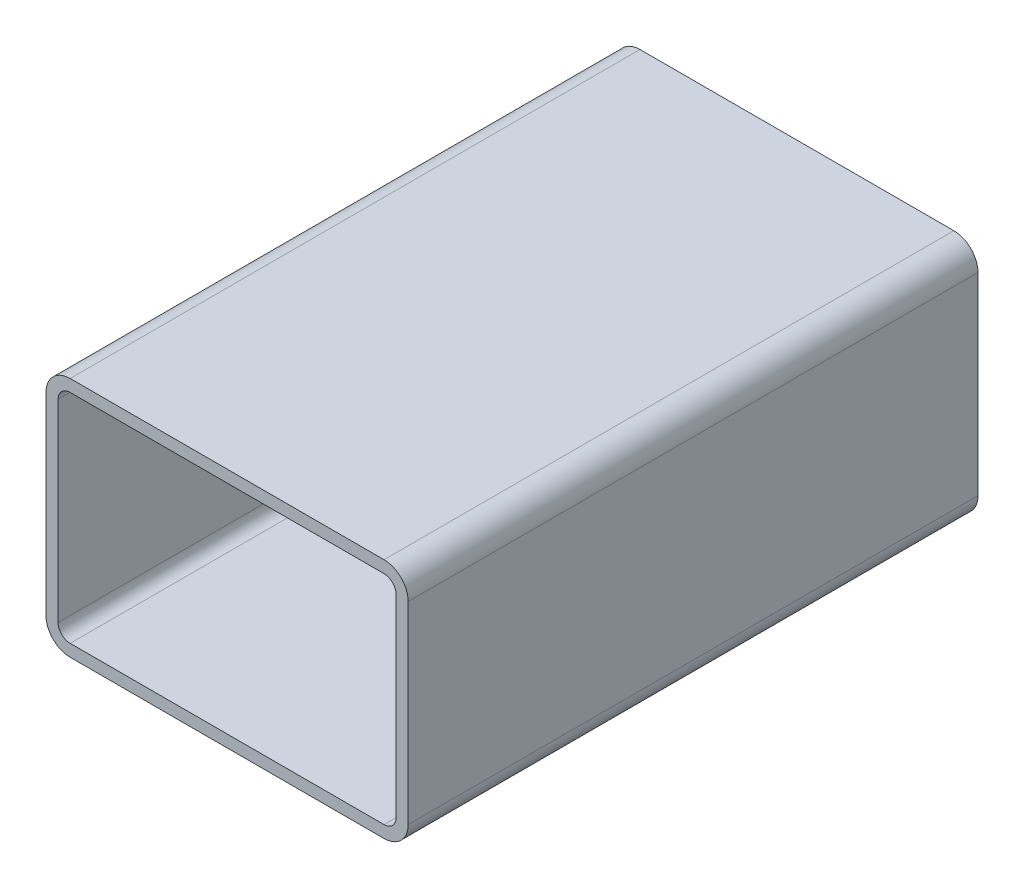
SolidWorks part; units mm, degrees
ref_plane "Plan de face" through (0, 0, 0) normal (0, 0, 1) x (1, 0, 0)
ref_plane "Plan de dessus" through (0, 0, 0) normal (0, 1, 0) x (1, 0, 0)
ref_plane "Plan de droite" through (0, 0, 0) normal (1, 0, 0) x (0, 0, -1)
sketch "Esquisse1" plane through (0, 0, 0) normal (0, 0, 1) x (1, 0, 0)
  line L0 (20.0001, 0) -> (280.0001, 0)
  line L1 (300.0001, 20) -> (300.0001, 180)
  line L2 (280.0001, 200) -> (20.0001, 200)
  line L3 (0.0001, 180) -> (0.0001, 20)
  line L4 (20.0001, 10) -> (280.0001, 10)
  line L5 (290.0001, 20) -> (290.0001, 180)
  line L6 (280.0001, 190) -> (20.0001, 190)
  line L7 (10.0001, 180) -> (10.0001, 20)
  arc A0 (280.0001, 0) -> (300.0001, 20) centre (280.0001, 20) ccw
  arc A1 (300.0001, 180) -> (280.0001, 200) centre (280.0001, 180) ccw
  arc A2 (20.0001, 200) -> (0.0001, 180) centre (20.0001, 180) ccw
  arc A3 (0.0001, 20) -> (20.0001, 0) centre (20.0001, 20) ccw
  arc A4 (280.0001, 10) -> (290.0001, 20) centre (280.0001, 20) ccw
  arc A5 (290.0001, 180) -> (280.0001, 190) centre (280.0001, 180) ccw
  arc A6 (20.0001, 190) -> (10.0001, 180) centre (20.0001, 180) ccw
  arc A7 (10.0001, 20) -> (20.0001, 10) centre (20.0001, 20) ccw
  dimension "D1" = 300
  dimension "D2" = 200
  dimension "D3" = 10
extrude "Extrusion1" add sketch "Esquisse1" along normal mid plane 472
